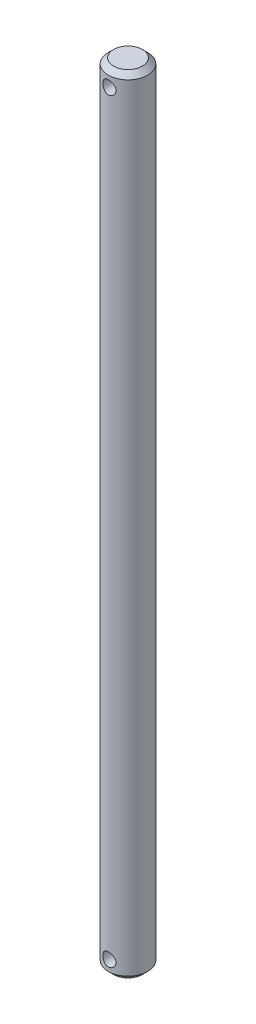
SolidWorks part; units mm, degrees
ref_plane "Front Plane" through (0, 0, 0) normal (0, 0, 1) x (1, 0, 0)
ref_plane "Top Plane" through (0, 0, 0) normal (0, 1, 0) x (1, 0, 0)
ref_plane "Right Plane" through (0, 0, 0) normal (1, 0, 0) x (0, 0, -1)
sketch "Sketch1" plane through (0, 0, 0) normal (0, 1, 0) x (1, 0, 0)
  circle A0 centre (0, 0) radius 4.7625
  dimension "D1" = 9.525
extrude "Extrude1" add sketch "Sketch1" along normal blind 190.5
chamfer "Chamfer1" distance 1.27 angle 45 2 edges at (0, 190.5, 4.7625) (0, 0, 4.7625)
ref_plane "Plane1" through (0, 0, 4.7625) normal (0, 0, 1) x (1, 0, 0)
sketch "Sketch2" plane through (0, 0, 4.7625) normal (0, 0, 1) x (1, 0, 0)
  line L0 (3.4925, 190.5) -> (-3.4925, 190.5) construction
  line L1 (-3.4925, 0) -> (3.4925, 0) construction
  circle A0 centre (0, 3.81) radius 1.5875
  circle A1 centre (0, 186.69) radius 1.5875
  dimension "D1" = 3.175
  dimension "D4" = 3.175
  dimension "D2" = 3.81
  dimension "D3" = 3.81
extrude "Cut-Extrude1" cut sketch "Sketch2" against normal through all
